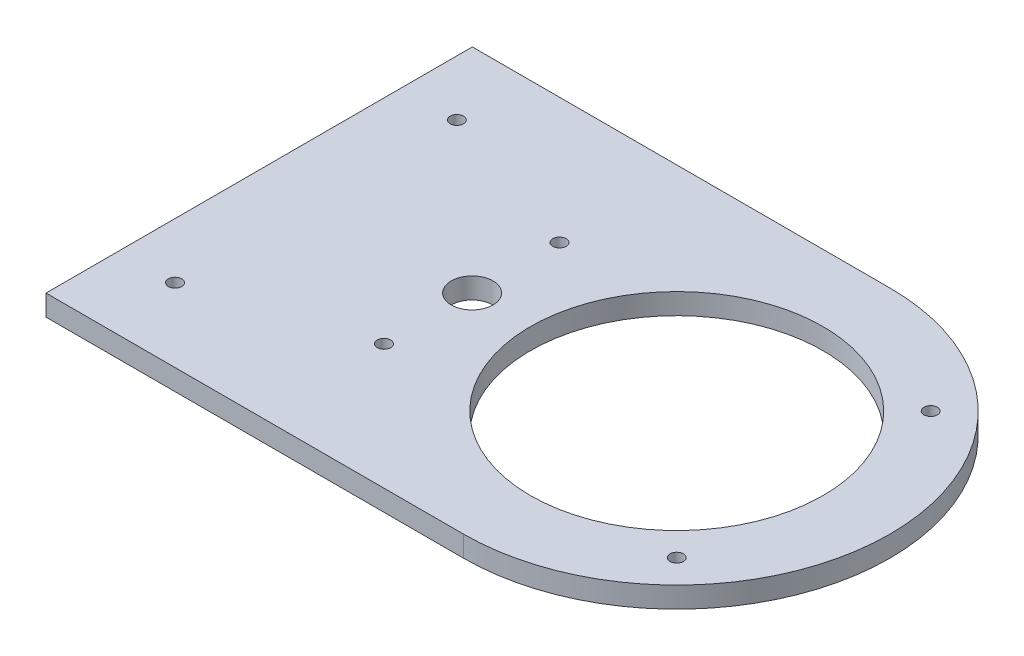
SolidWorks part; units mm, degrees
ref_plane "Front Plane" through (0, 0, 0) normal (0, 0, 1) x (1, 0, 0)
ref_plane "Top Plane" through (0, 0, 0) normal (0, 1, 0) x (1, 0, 0)
ref_plane "Right Plane" through (0, 0, 0) normal (1, 0, 0) x (0, 0, -1)
sketch "Sketch1" plane through (0, 0, 0) normal (0, 1, 0) x (1, 0, 0)
  line L1 (-100, -51.05) -> (78, -51.05)
  line L2 (-100, -51.05) -> (-100, 51.05)
  line L3 (-100, 51.05) -> (78, 51.05)
  line L4 (78, -51.05) -> (78, 51.05)
  circle A0 centre (0, 0) radius 35.05
  circle A1 centre (-49, 0) radius 5
extrude "Boss-Extrude1" add sketch "Sketch1" along normal blind 5
sketch "Sketch2" plane through (0, 0, 0) normal (0, 1, 0) x (1, 0, 0)
  line L0 (0, 0) -> (0, 43) construction
  line L1 (0, 0) -> (30.4056, 30.4056) construction
  circle A1 centre (30.4056, 30.4056) radius 1.25
  circle A2 centre (30.4056, -30.4056) radius 1.25
  circle A3 centre (0, 0) radius 37 construction
  circle A4 centre (0, 0) radius 43 construction
  circle A7 centre (-30.4056, 30.4056) radius 1.25
  circle A8 centre (-30.4056, -30.4056) radius 1.25
  point P17 (0, 0)
  dimension "D1" = 74
  dimension "D3" = 2.5
  dimension "D2" = 45
  dimension "D4" = 6
  dimension "D5" = 4
hole_wizard "CSK for M3 Countersunk Flat Head Screw1" positions "Sketch9" profile "Sketch10" countersink size "M3" standard "ISO"
sketch "Sketch9" plane through (0, 0, 0) normal (0, -1, 0) x (-1, 0, 0)
  point P3 (-30.4056, -30.4056)
  point P6 (-30.4056, 30.4056)
sketch "Sketch10" plane through (30.4056, 0, 30.4056) normal (1, 0, 0) x (0, 0, -1)
  line L0 (0, 0) -> (0, 5)
  line L1 (0, 5) -> (1.6, 5)
  line L2 (1.6, 5) -> (1.6, 1.55)
  line L3 (1.6, 1.55) -> (3.15, 0)
  line L5 (3.15, 0) -> (0, 0)
  line L6 (-1.6, 1.55) -> (-3.15, 0) construction
  line L11 (0, -6.35) -> (0, 107.95) construction
  dimension "Thru Hole Dia." = 3.2
  dimension "Thru Hole Depth" = 5
  dimension "Near C'Sink Dia." = 6.3
  dimension "Near C'Sink Angle" = 90
sketch "Sketch12" plane through (0, 5, 0) normal (0, 1, 0) x (1, 0, 0)
  line L0 (78, 51.05) -> (-100, 51.05) construction
  line L1 (0, 51.05) -> (78, 51.05)
  line L2 (78, 51.05) -> (78, -51.05)
  line L3 (78, -51.05) -> (0, -51.05)
  arc A0 (0, -51.05) -> (0, 51.05) centre (0, 0) ccw
extrude "Cut-Extrude2" cut sketch "Sketch12" against normal through all
sketch "Sketch13" plane through (0, 0, 0) normal (0, 1, 0) x (1, 0, 0)
  circle A0 centre (-49, -21.11) radius 1.6
  circle A1 centre (-49, 20.91) radius 1.6
  dimension "D1" = 3.2
  dimension "D2" = 49
  dimension "D3" = 21.11
  dimension "D4" = 42.02
hole_wizard "CSK for M3 Countersunk Flat Head Screw2" positions "Sketch14" profile "Sketch16" countersink size "M3" standard "ISO"
sketch "Sketch14" plane through (0, 0, 0) normal (0, -1, 0) x (-1, 0, 0)
  point P0 (49, 20.91)
  point P3 (49, -21.11)
sketch "Sketch16" plane through (-49, 0, -20.91) normal (1, 0, 0) x (0, 0, -1)
  line L0 (0, 0) -> (0, 5)
  line L1 (0, 5) -> (1.6, 5)
  line L2 (1.6, 5) -> (1.6, 1.55)
  line L3 (1.6, 1.55) -> (3.15, 0)
  line L5 (3.15, 0) -> (0, 0)
  line L6 (-1.6, 1.55) -> (-3.15, 0) construction
  line L11 (0, -6.35) -> (0, 107.95) construction
  dimension "Thru Hole Dia." = 3.2
  dimension "Thru Hole Depth" = 5
  dimension "Near C'Sink Dia." = 6.3
  dimension "Near C'Sink Angle" = 90
sketch "Sketch17" plane through (0, 0, 0) normal (0, -1, 0) x (-1, 0, 0)
  line L0 (0, 51.05) -> (100, 51.05) construction
  line L1 (100, -51.05) -> (0, -51.05) construction
  line L2 (100, 51.05) -> (100, -51.05) construction
  circle A0 centre (86.7, 34.05) radius 1.85
  circle A1 centre (86.7, -33.45) radius 1.85
  circle A4 centre (49, 0) radius 5 construction
  circle A5 centre (49, 0) radius 5 construction
hole_wizard "CSK for M3 Countersunk Flat Head Screw3" positions "Sketch18" profile "Sketch19" countersink size "M3" standard "ISO"
sketch "Sketch18" plane through (0, 0, 0) normal (0, -1, 0) x (-1, 0, 0)
  point P3 (86.7, 34.05)
  point P6 (86.7, -33.45)
sketch "Sketch19" plane through (-86.7, 0, -34.05) normal (1, 0, 0) x (0, 0, -1)
  line L0 (0, 0) -> (0, 5)
  line L1 (0, 5) -> (1.6, 5)
  line L2 (1.6, 5) -> (1.6, 1.55)
  line L3 (1.6, 1.55) -> (3.15, 0)
  line L5 (3.15, 0) -> (0, 0)
  line L6 (-1.6, 1.55) -> (-3.15, 0) construction
  line L11 (0, -6.35) -> (0, 107.95) construction
  dimension "Thru Hole Dia." = 3.2
  dimension "Thru Hole Depth" = 5
  dimension "Near C'Sink Dia." = 6.3
  dimension "Near C'Sink Angle" = 90
equation "\"D4@Sketch1\"=\"D1@Sketch1\"/2+16mm"
equation "\"D6@Sketch1\"=\"D4@Sketch1\"*2"
equation "\"D3@Sketch17\"=\"D4@Sketch17\""
